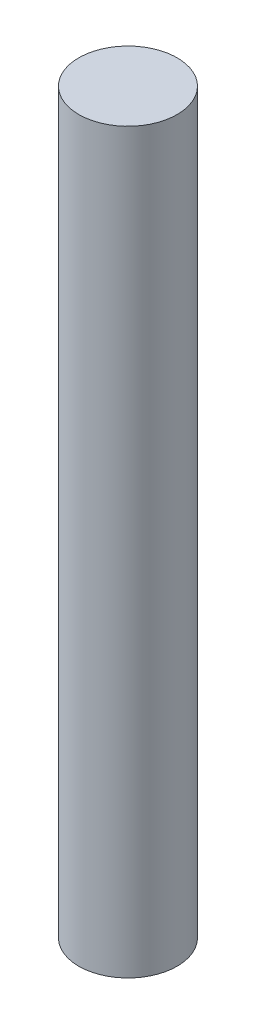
SolidWorks part; units mm, degrees
ref_plane "Front" through (0, 0, 0) normal (0, 0, 1) x (1, 0, 0)
ref_plane "Top" through (0, 0, 0) normal (0, 1, 0) x (1, 0, 0)
ref_plane "Right" through (0, 0, 0) normal (1, 0, 0) x (0, 0, -1)
sketch "Sketch1" plane through (0, 0, 0) normal (0, 1, 0) x (1, 0, 0)
  circle A0 centre (0, 0) radius 2
extrude "Extrude1" add sketch "Sketch1" along normal blind 30
